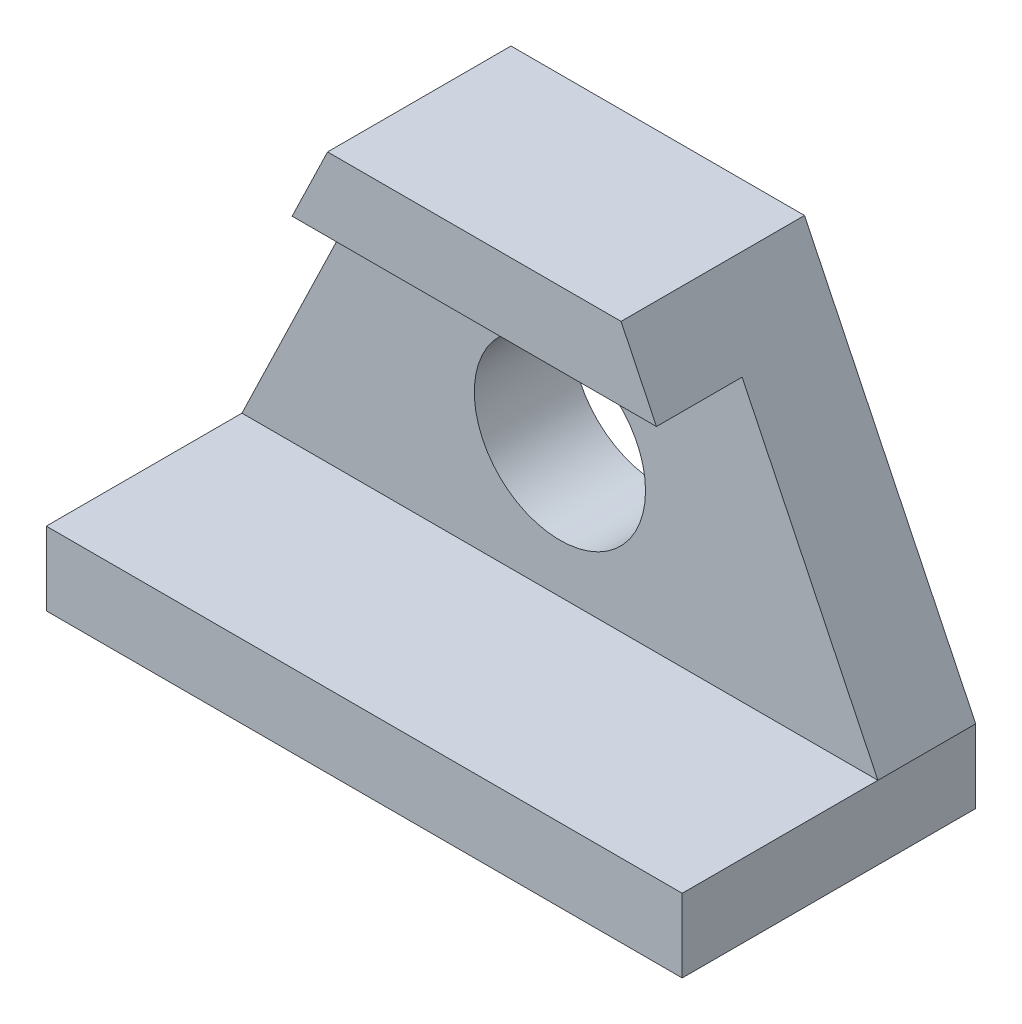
SolidWorks part; units mm, degrees
ref_plane "前视基准面" through (0, 0, 0) normal (0, 0, 1) x (1, 0, 0)
ref_plane "上视基准面" through (0, 0, 0) normal (0, 1, 0) x (1, 0, 0)
ref_plane "右视基准面" through (0, 0, 0) normal (1, 0, 0) x (0, 0, -1)
sketch "草图1" plane through (0, 0, 0) normal (1, 0, 0) x (0, 0, -1)
  line L0 (0, 0) -> (0, 35)
  line L1 (0, 35) -> (-15, 35)
  line L2 (-15, 35) -> (-15, 29)
  line L3 (-15, 29) -> (-8, 29)
  line L4 (-8, 29) -> (-8, 6)
  line L5 (-8, 6) -> (-24, 6)
  line L6 (-24, 6) -> (-24, 0)
  line L7 (-24, 0) -> (0, 0)
  dimension "D1" = 35
  dimension "D2" = 15
  dimension "D3" = 6
  dimension "D4" = 6
  dimension "D5" = 24
  dimension "D6" = 16
extrude "拉伸1" add sketch "草图1" along normal mid plane 52
sketch "草图2" plane through (0, 0, 0) normal (0, 0, -1) x (-1, 0, 0)
  line L0 (26, 6) -> (12, 35)
  line L1 (-26, 35) -> (26, 35) construction
  line L2 (12, 35) -> (26, 35)
  line L3 (0, 0) -> (0, 58.8962) construction
  line L4 (26, 35) -> (26, 6)
  point P10 (0, 35)
extrude "切除-拉伸1" cut sketch "草图2" against normal blind 52
mirror "镜向1" about plane through (0, 0, 0) normal (1, 0, 0) of "切除-拉伸1"
sketch "草图3" plane through (0, 0, 8) normal (0, 0, 1) x (1, 0, 0)
  circle A0 centre (0, 17) radius 7
  dimension "D1" = 17
extrude "切除-拉伸2" cut sketch "草图3" against normal through all
